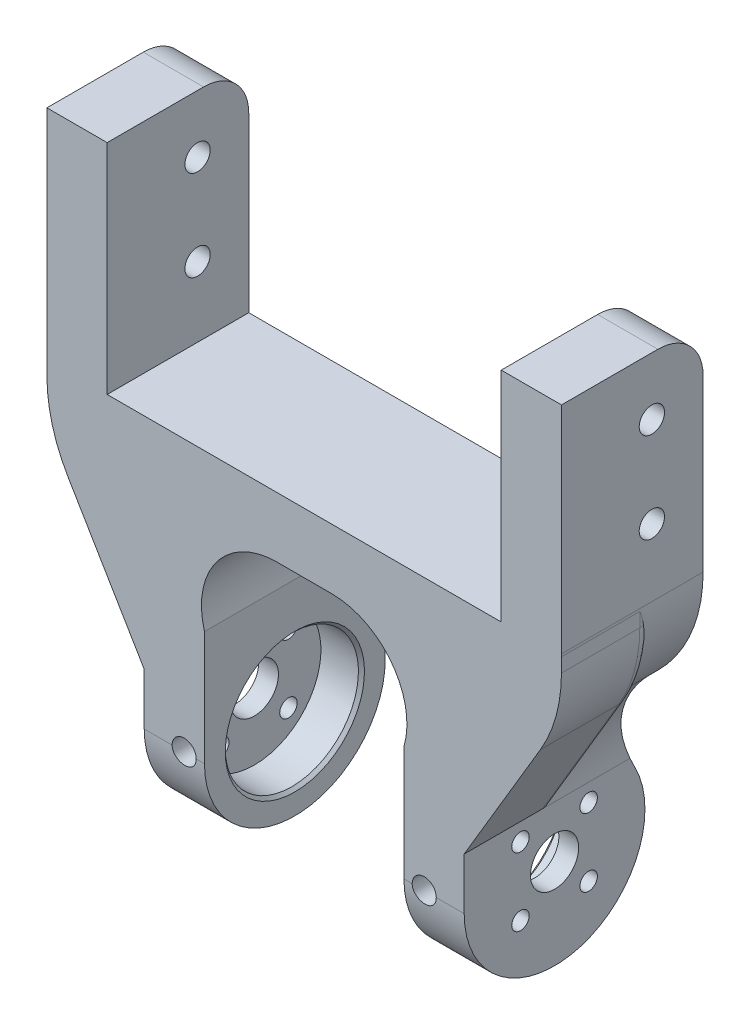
SolidWorks part; units mm, degrees
ref_plane "Front Plane" through (0, 0, 0) normal (0, 0, 1) x (1, 0, 0)
ref_plane "Top Plane" through (0, 0, 0) normal (0, 1, 0) x (1, 0, 0)
ref_plane "Right Plane" through (0, 0, 0) normal (1, 0, 0) x (0, 0, -1)
sketch "Sketch1" plane through (0, 0, 0) normal (0, 0, 1) x (1, 0, 0)
  line L1 (-32.5, -18) -> (32.5, -18) construction
  line L2 (-32.5, -18) -> (-32.5, 18) construction
  line L3 (-32.5, 18) -> (32.5, 18) construction
  line L4 (32.5, -18) -> (32.5, 18) construction
  line L5 (-32.5, -18) -> (32.5, 18) construction
  line L6 (-32.5, 18) -> (32.5, -18) construction
  point P0 (0, 0)
  dimension "D1" = 65
  dimension "D2" = 36
sketch "Sketch2" plane through (0, 0, 0) normal (0, 0, 1) x (1, 0, 0)
  line L0 (0, 18) -> (0, -18) construction
  line L1 (-32.5, 18) -> (32.5, 18) construction
  line L2 (-32.5, -18) -> (32.5, -18) construction
  line L3 (-32.7, 18) -> (-32.7, -18.2)
  line L4 (-32.7, -18.2) -> (32.7, -18.2)
  line L5 (-32.7, 18) -> (-42.7, 18)
  line L6 (-42.7, 18) -> (-42.7, -18.2)
  line L7 (-32.5, -18) -> (-32.5, 18) construction
  line L8 (0, -18.2) -> (0, -63.2) construction
  line L9 (32.7, -28.2) -> (-32.7, -28.2)
  line L10 (-32.7, -18.2) -> (-32.7, -28.2) construction
  line L11 (-42.7, -18.2) -> (-32.7, -18.2) construction
  line L12 (16.55, -63.2) -> (-16.55, -63.2) construction
  line L13 (-16.55, -78.2) -> (-16.55, -48.2)
  line L14 (-16.55, -48.2) -> (16.55, -48.2) construction
  line L15 (-26.55, -48.2) -> (-26.55, -78.2)
  line L16 (-26.55, -78.2) -> (-16.55, -78.2)
  line L18 (16.55, -44.2) -> (-16.55, -44.2) construction
  line L19 (-16.55, -44.2) -> (-32.7, -28.2)
  line L20 (-16.55, -44.2) -> (-16.55, -48.2)
  line L21 (-26.55, -48.2) -> (-16.55, -48.2) construction
  line L22 (26.55, -48.2) -> (16.55, -48.2) construction
  line L23 (16.55, -44.2) -> (16.55, -48.2)
  line L24 (42.7, -18.2) -> (32.7, -18.2) construction
  line L25 (32.7, -18.2) -> (32.7, -28.2) construction
  line L26 (16.55, -44.2) -> (32.7, -28.2)
  line L28 (26.55, -78.2) -> (16.55, -78.2)
  line L29 (26.55, -48.2) -> (26.55, -78.2)
  line L30 (16.55, -78.2) -> (16.55, -48.2)
  line L31 (42.7, 18) -> (42.7, -18.2)
  line L32 (32.7, 18) -> (42.7, 18)
  line L33 (32.7, 18) -> (32.7, -18.2)
  line L34 (-42.7, -18.2) -> (-42.7, -28.2)
  line L35 (-42.7, -28.2) -> (-26.55, -44.2)
  line L36 (-26.55, -44.2) -> (-26.55, -48.2)
  line L37 (-42.7, -28.2) -> (-32.7, -28.2) construction
  line L38 (26.55, -44.2) -> (26.55, -48.2)
  line L39 (42.7, -28.2) -> (26.55, -44.2)
  line L40 (42.7, -18.2) -> (42.7, -28.2)
  point P22 (-16.55, -63.2)
  point P23 (0, -28.2)
  point P35 (0, -44.2)
  point P37 (0, -48.2)
  point P39 (16.55, -63.2)
  point P43 (-26.55, -35.7)
  point P44 (-16.55, -42.43)
  dimension "D1" = 0.2
  dimension "D2" = 0.2
  dimension "D3" = 10
  dimension "D4" = 45
  dimension "D5" = 33.1
  dimension "D6" = 30
  dimension "D7" = 16
extrude "Boss-Extrude1" add sketch "Sketch2" along normal mid plane 30
fillet "Fillet1" radius 15 4 edges at (-21.55, -78.2, -15) (-21.55, -78.2, 15) (21.55, -78.2, -15) (21.55, -78.2, 15)
sketch "Sketch3" plane through (0, 0, 0) normal (1, 0, 0) x (0, 0, -1)
  line L0 (0, -78.2) -> (0, 18) construction
  line L1 (0, 18) -> (0, -18) construction
  line L2 (0, -18) -> (0, 18) construction
  line L3 (8.5, 18) -> (-8.5, 18)
  line L4 (-15, 18) -> (15, 18) construction
  line L5 (-8.5, 18) -> (-8.5, -18) construction
  line L6 (-8.5, -18) -> (0, -18) construction
  line L7 (-15, -63.2) -> (15, -63.2) construction
  line L8 (-8.5, -18) -> (-8.5, -50.8408) construction
  line L9 (8.5, 18) -> (8.5, -18)
  line L10 (8.5, -18) -> (8.5, -50.8408)
  line L11 (-8.5, 18) -> (-15, 18)
  line L12 (-15, 18) -> (-15, -63.2)
  arc A0 (-15, -63.2) -> (15, -63.2) centre (0, -63.2) ccw
  arc A1 (0, -78.2) -> (15, -63.2) centre (0, -63.2) ccw construction
  arc A2 (-15, -63.2) -> (15, -63.2) centre (0, -63.2) cw construction
  arc A3 (-15, -63.2) -> (-8.5, -50.8408) centre (0, -63.2) cw construction
  arc A4 (15, -63.2) -> (8.5, -50.8408) centre (0, -63.2) ccw
  point P12 (0, 18)
  point P14 (0, -18)
  dimension "D2" = 32.8408
  dimension "D1" = 17
extrude "Cut-Extrude1" cut sketch "Sketch3" against normal through all both and the other way through all flip side to cut
fillet "Fillet2" [suppressed] radius 35
fillet "Fillet3" [suppressed] radius 75
fillet "Fillet4" [suppressed] radius 75
sketch "Sketch4" plane through (0, 0, 0) normal (1, 0, 0) x (0, 0, -1)
  line L0 (0, 18) -> (0, -18) construction
  line L1 (0, 18) -> (0, -18) construction
  circle A1 centre (0, -6.6) radius 2.1
  circle A2 centre (0, 8.4) radius 2.1
  circle A3 centre (0, -63.2) radius 3.995
  dimension "D3" = 4.2
  dimension "D4" = 7.99
  dimension "D1" = 15
  dimension "D2" = 26.4
extrude "Cut-Extrude2" cut sketch "Sketch4" against normal through all both and the other way through all
fillet "Fillet5" [suppressed] radius 7.5
ref_plane "Plane1" through (0, 0, 0) normal (-1, 0, 0) x (0, 0, 1)
fillet "Fillet7" [suppressed] radius 190.5
sketch "Sketch8" plane through (16.55, 0, 0) normal (-1, 0, 0) x (0, 0, 1)
  circle A0 centre (0, -63.2) radius 11.05
  dimension "D1" = 22.1
extrude "Cut-Extrude5" cut sketch "Sketch8" against normal blind 6.72 contours A0
sketch "Sketch10" plane through (23.27, 0, 0) normal (-1, 0, 0) x (0, 0, 1)
  line L0 (0, -63.2) -> (5.6569, -57.5431) construction
  line L1 (0, -63.2) -> (5.6569, -68.8569) construction
  line L2 (0, -63.2) -> (-5.6569, -68.8569) construction
  line L3 (0, -63.2) -> (-5.6569, -57.5431) construction
  line L4 (0, -63.2) -> (0, -78.2) construction
  circle A0 centre (5.6569, -57.5431) radius 1.45
  circle A1 centre (5.6569, -68.8569) radius 1.45
  circle A2 centre (-5.6569, -68.8569) radius 1.45
  circle A3 centre (-5.6569, -57.5431) radius 1.45
  arc A4 (-8.5, -50.8408) -> (15, -63.2) centre (0, -63.2) ccw construction
  dimension "D2" = 2.9
  dimension "D3" = 4
  dimension "D1" = 8
  dimension "D4" = 45
extrude "Cut-Extrude6" cut sketch "Sketch10" against normal up to next
mirror "Mirror11" about plane through (0, 0, 0) normal (-1, 0, 0) of "Cut-Extrude6", "Cut-Extrude5"
chamfer "Chamfer1" distance 0.5 angle 45 2 edges at (16.55, -74.25, 0) (-16.55, -74.25, 0)
sketch "Sketch12" plane through (0, 0, 15) normal (0, 0, 1) x (1, 0, 0)
  line L0 (0, 0) -> (0, -63.2) construction
  line L1 (-16.55, -74.75) -> (-16.55, -51.65) construction
  line L2 (-16.55, -74.75) -> (-16.55, -51.65) construction
  line L3 (0, -63.2) -> (-16.55, -63.2) construction
  line L4 (-23.27, -74.25) -> (-23.27, -52.15) construction
  line L5 (-23.27, -74.25) -> (-23.27, -52.15) construction
  line L6 (-16.55, -63.2) -> (-23.27, -63.2) construction
  line L7 (16.55, -63.2) -> (26.55, -63.2) construction
  circle A0 centre (-19.92, -63.2) radius 2
  circle A1 centre (19.92, -63.2) radius 2
  point P13 (-19.91, -63.2)
  point P14 (-19.91, -63.2)
  point P15 (19.92, -63.2)
  dimension "D1" = 4
  dimension "D2" = 3.35
extrude "Cut-Extrude7" cut sketch "Sketch12" against normal up to next
fillet "Fillet9" radius 7.5 2 edges at (-37.7, 18, -8.5) (37.7, 18, -8.5)
fillet "Fillet11" radius 12.5 2 edges at (32.7, -28.2, 3.25) (-32.7, -28.2, 3.25)
fillet "Fillet12" radius 25 4 edges at (-26.55, -44.2, 3.25) (26.55, -44.2, 3.25) (42.7, -28.2, 3.25) (-42.7, -28.2, 3.25)
fillet "Fillet13" radius 45 2 edges at (21.6939, -50.8408, -8.5) (-21.6939, -50.8408, -8.5)
sketch "Sketch13" plane through (0, 0, 15) normal (0, 0, 1) x (1, 0, 0)
  line L1 (-42.6964, -18.2) -> (-26.55, -18.2)
  line L2 (-26.55, -18.2) -> (-26.55, -54.6237)
  line L3 (-26.55, -54.6237) -> (0, -54.6237) construction
  line L4 (0, -54.6237) -> (0, 0) construction
  line L5 (26.55, -18.2) -> (26.55, -54.6237)
  line L6 (42.6964, -18.2) -> (26.55, -18.2)
  line L8 (-42.6964, -18.2) -> (-42.6964, -27.3972)
  line L9 (-42.6964, -27.3972) -> (-26.55, -54.6237)
  line L10 (-42.6964, -27.3972) -> (-40.7746, -27.3972) construction
  line L11 (32.7, -18.2) -> (-32.7, -18.2) construction
  line L12 (42.6964, -18.2) -> (42.6964, -27.3972)
  line L13 (42.6964, -27.3972) -> (26.55, -54.6237)
  arc A1 (-42.7, -17.7763) -> (-35.295, -35.5362) centre (-17.7, -17.7763) ccw construction
  point P0 (-26.55, -54.6237)
  point P4 (-40.7746, -27.3972)
  point P14 (26.55, -54.6237)
  point P19 (-26.55, -17.7763)
  point P20 (-26.55, -18.2)
  point P23 (-43.0714, -27.3972)
  point P24 (-42.7, -17.7763)
extrude "Boss-Extrude2" add sketch "Sketch13" against normal blind 15
fillet "Fillet15" radius 25 1 edges at (-42.6964, -27.3972, 7.5)
fillet "Fillet16" radius 25 1 edges at (42.6964, -27.3972, 7.5)
fillet "Fillet17" radius 2 4 edges at (-42.6964, -19.3708, 0) (42.6964, -19.3708, 0) (-32.8747, -43.9588, 0) (32.8747, -43.9588, 0)
